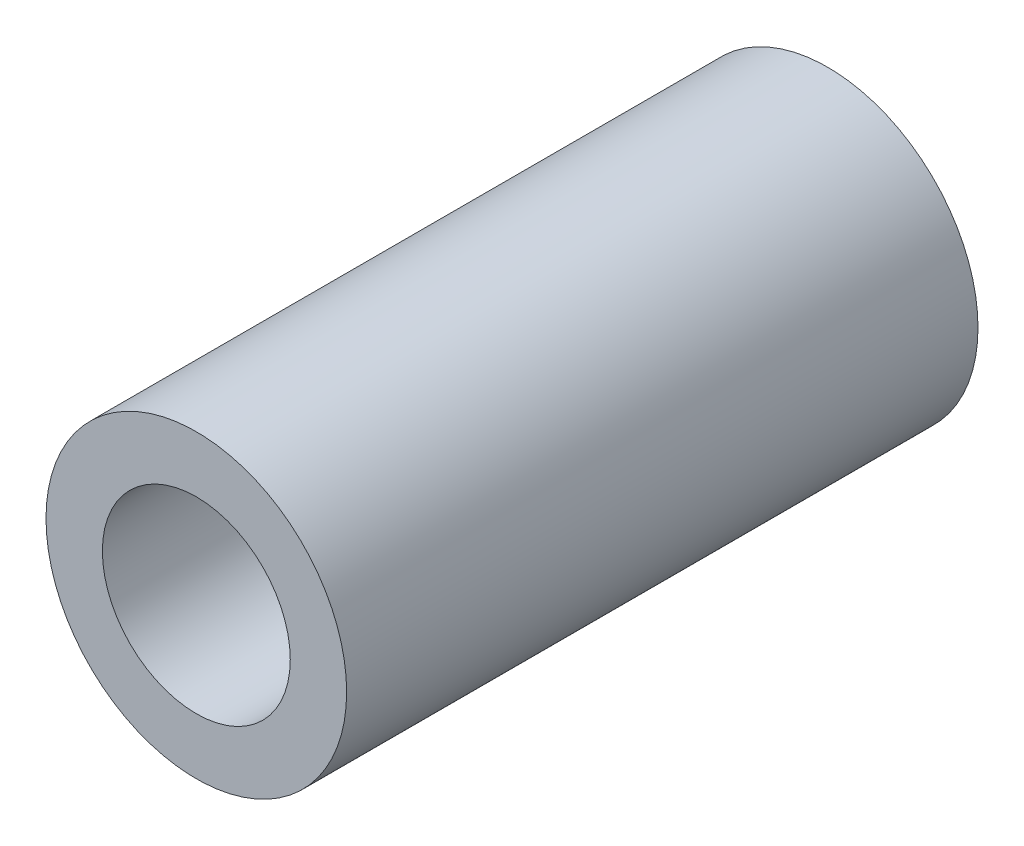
SolidWorks part; units mm, degrees
ref_plane "Plan de face" through (0, 0, 0) normal (0, 0, 1) x (1, 0, 0)
ref_plane "Plan de dessus" through (0, 0, 0) normal (0, 1, 0) x (1, 0, 0)
ref_plane "Plan de droite" through (0, 0, 0) normal (1, 0, 0) x (0, 0, -1)
sketch "Esquisse1" plane through (0, 0, 0) normal (0, 0, 1) x (1, 0, 0)
  circle A0 centre (0, 0) radius 10
  circle A1 centre (0, 0) radius 6.25
  dimension "D1" = 20
  dimension "D2" = 12.5
extrude "Extrusion1" add sketch "Esquisse1" along normal blind 42
